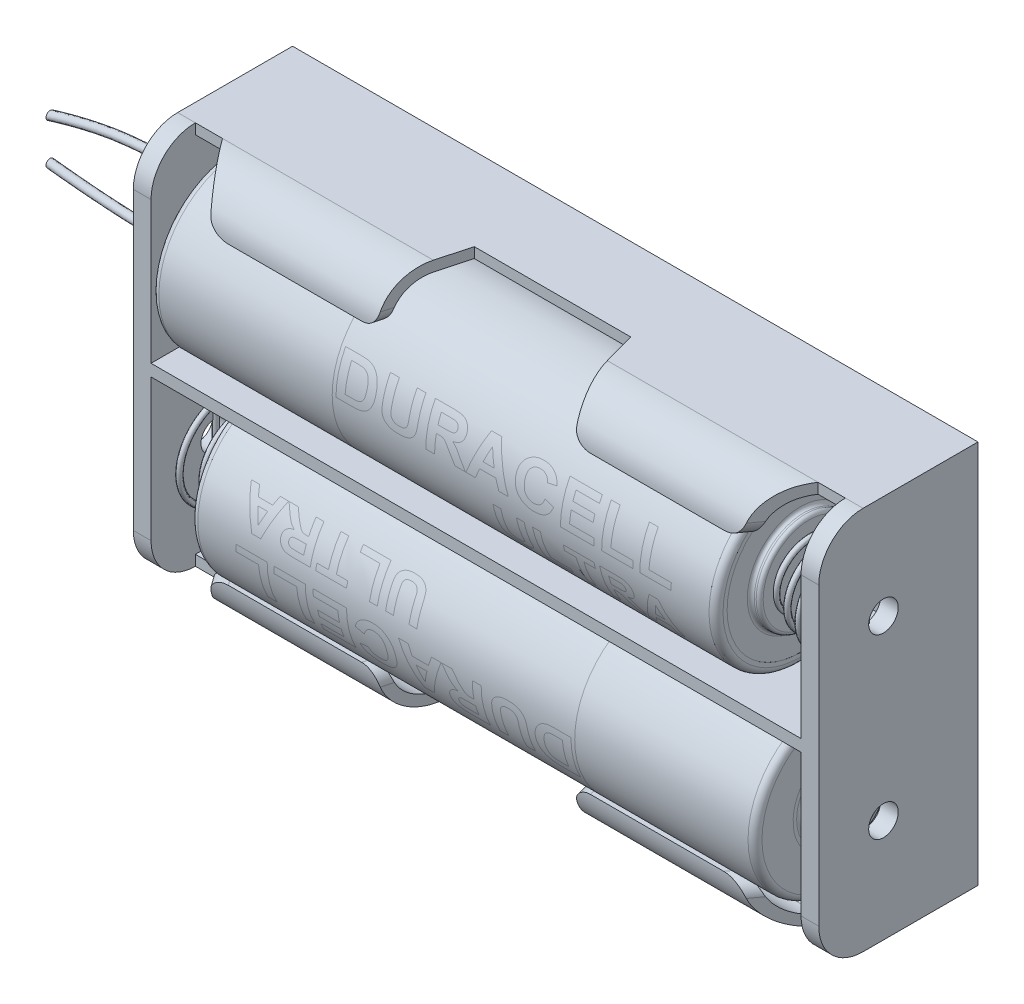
SolidWorks part; units mm, degrees
ref_plane "Front Plane" through (0, 0, 0) normal (0, 0, 1) x (1, 0, 0)
ref_plane "Top Plane" through (0, 0, 0) normal (0, 1, 0) x (1, 0, 0)
ref_plane "Right Plane" through (0, 0, 0) normal (1, 0, 0) x (0, 0, -1)
imported_body "Imported30"
imported_body "Imported31"
imported_body "Imported32"
imported_body "Imported33"
imported_body "Imported34"
imported_body "Imported35"
imported_body "Imported36"
imported_body "Surface-Imported60"
sketch "Sketch1" plane through (0, 0, 0) normal (0, 0, -1) x (-1, 0, 0)
  line L1 (49.4762, 12.4336) -> (94.6198, 12.4336)
  line L2 (49.4762, 12.4336) -> (49.4762, -18.1722)
  line L3 (49.4762, -18.1722) -> (94.6198, -18.1722)
  line L4 (94.6198, 12.4336) -> (94.6198, -18.1722)
extrude "Cut-Extrude1" cut sketch "Sketch1" against normal mid plane 30
